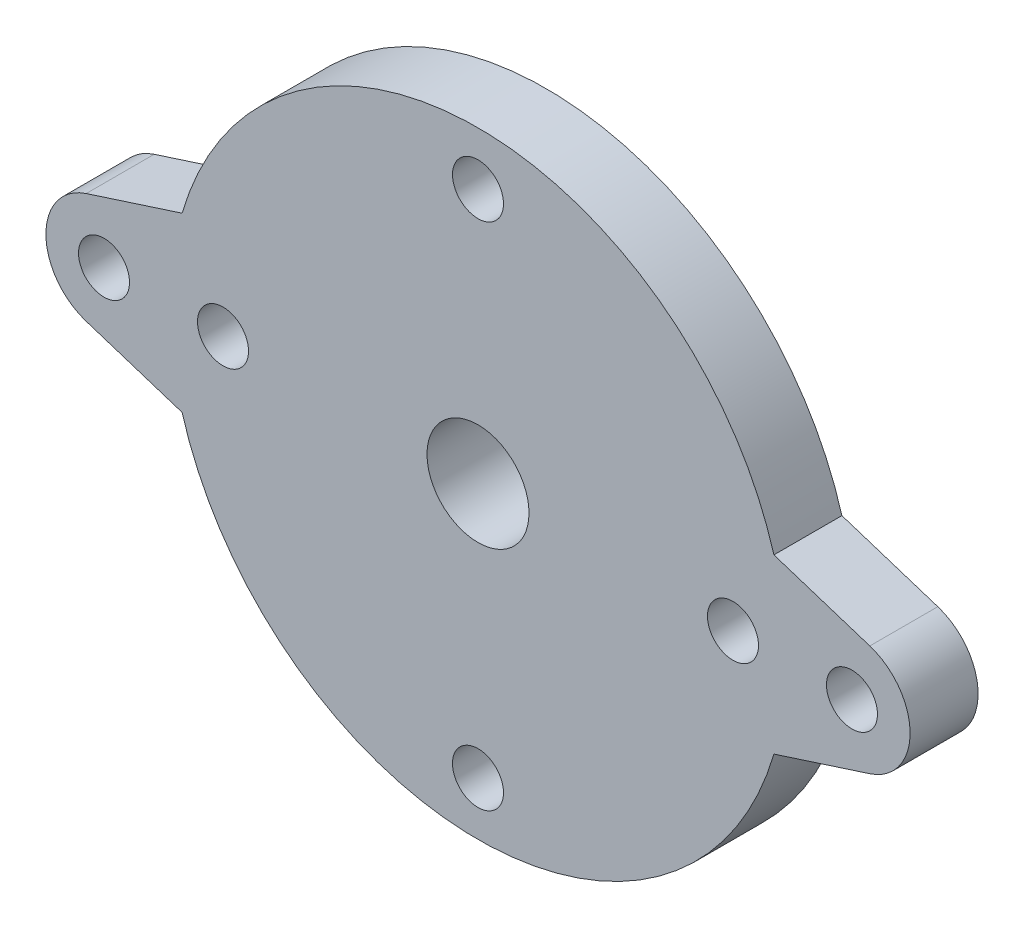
SolidWorks part; units mm, degrees
ref_plane "前视" through (0, 0, 0) normal (0, 0, 1) x (1, 0, 0)
ref_plane "上视" through (0, 0, 0) normal (0, 1, 0) x (1, 0, 0)
ref_plane "右视" through (0, 0, 0) normal (1, 0, 0) x (0, 0, -1)
sketch "草图1" plane through (0, 0, 0) normal (0, 0, 1) x (1, 0, 0)
  line L2 (23.0493, -3.2551) -> (17.4078, -5.0737)
  line L3 (-23.0493, 3.2551) -> (-17.4078, 5.0737)
  line L4 (23.0493, 3.2551) -> (17.4078, 5.0737)
  line L5 (-23.0493, -3.2551) -> (-17.4078, -5.0737)
  circle A0 centre (0, 0) radius 18.1321
  circle A1 centre (-22, 0) radius 3.42
  circle A2 centre (22, 0) radius 3.42
  dimension "D1" = 44
  dimension "D2" = 22
extrude "凸台-拉伸1" add sketch "草图1" along normal blind 4
sketch "草图2" plane through (0, 0, 0) normal (0, 0, -1) x (-1, 0, 0)
  circle A0 centre (-22, 0) radius 1.5
  circle A1 centre (22, 0) radius 1.5
  point P8 (-23.4288, 0.7003)
  dimension "D1" = 44
  dimension "D2" = 22
extrude "切除-拉伸1" cut sketch "草图2" against normal blind 4
sketch "草图3" plane through (0, 0, 0) normal (0, 0, -1) x (-1, 0, 0)
  circle A0 centre (0, 0) radius 8
  circle A1 centre (0, 0) radius 8.4
extrude "切除-拉伸2" cut sketch "草图3" against normal blind 0.5
sketch "草图4" plane through (0, 0, 0) normal (0, 0, -1) x (-1, 0, 0)
  circle A0 centre (0, 0) radius 8
extrude "凸台-拉伸2" add sketch "草图4" along normal blind 2.2
sketch "草图5" plane through (0, 0, -2.2) normal (0, 0, -1) x (-1, 0, 0)
  circle A0 centre (0, 0) radius 3
extrude "切除-拉伸3" cut sketch "草图5" against normal blind 20
sketch "草图6" plane through (0, 0, 0) normal (0, 0, -1) x (-1, 0, 0)
  circle A0 centre (-22, 0) radius 3
  circle A1 centre (22, 0) radius 3
extrude "切除-拉伸4" cut sketch "草图6" against normal blind 0.2
sketch "草图7" plane through (0, 0, 0) normal (0, 0, -1) x (-1, 0, 0)
  circle A1 centre (-15, 0) radius 2
  circle A2 centre (0, 15) radius 2
  circle A3 centre (15, 0) radius 2
  circle A4 centre (0, -15) radius 2
extrude "切除-拉伸5" cut sketch "草图7" against normal blind 1.5
sketch "草图9" plane through (0, 0, 1.5) normal (0, 0, -1) x (-1, 0, 0)
  circle A0 centre (-15, 0) radius 1.5
  circle A1 centre (0, 15) radius 1.5
  circle A2 centre (15, 0) radius 1.5
  circle A3 centre (0, -15) radius 1.5
extrude "切除-拉伸6" cut sketch "草图9" against normal blind 3
